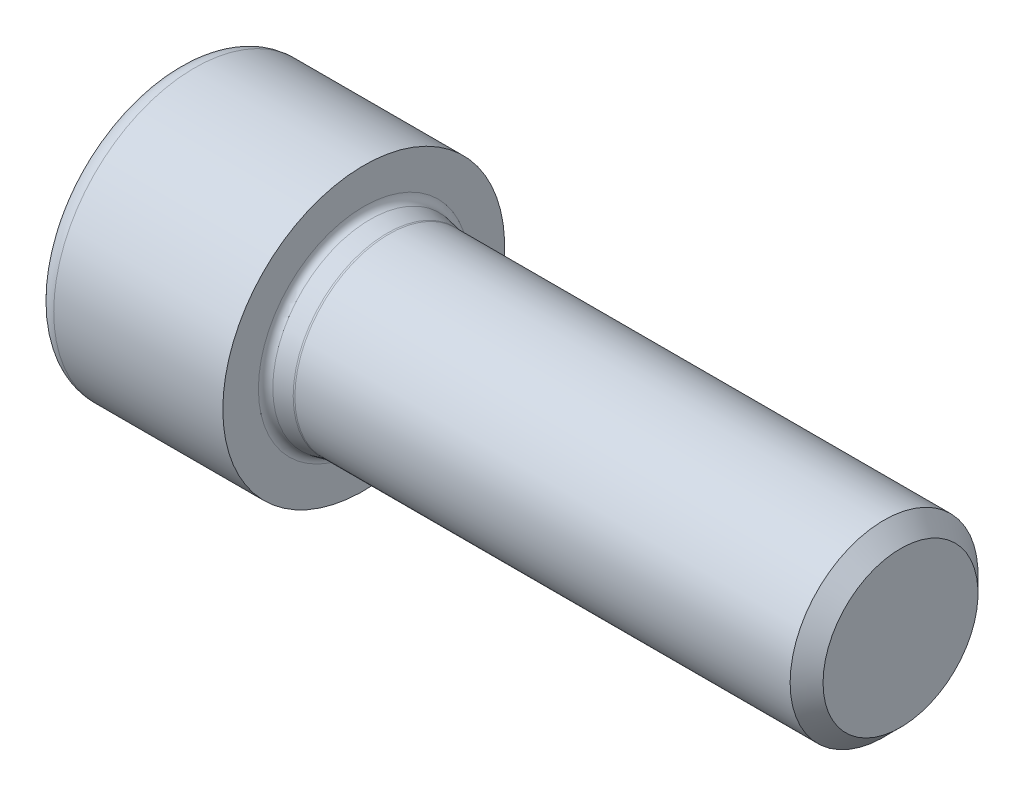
SolidWorks part; units mm, degrees
ref_plane "Ebene vorne" through (0, 0, 0) normal (0, 0, 1) x (1, 0, 0)
ref_plane "Ebene oben" through (0, 0, 0) normal (0, 1, 0) x (1, 0, 0)
ref_plane "Ebene rechts" through (0, 0, 0) normal (1, 0, 0) x (0, 0, -1)
ref_plane "Ebene1" through (0, 0, 0) normal (0, 1, 0) x (-1, 0, 0)
sketch "Skizze1" plane through (0, 0, 0) normal (0, 1, 0) x (-1, 0, 0)
  line L0 (2.3359, 0) -> (5.8, -6)
  line L1 (5.8, -6) -> (13.14, -6)
  line L2 (13.14, -6) -> (14, -6.86)
  line L3 (14, -6.86) -> (14, -9.1)
  line L4 (12.6, -10.5) -> (0, -10.5)
  line L5 (0, -10.5) -> (0, -7.85)
  line L6 (-0.4841, -7.2613) -> (-1.7541, -7.0113)
  line L7 (-1.87, -7) -> (-38.773, -7)
  line L8 (-38.773, -7) -> (-40, -5.773)
  line L9 (-40, -5.773) -> (-40, 0)
  line L10 (-40, 0) -> (2.3359, 0)
  line L11 (-40, 0) -> (14, 0) construction
  arc A0 (14, -9.1) -> (12.6, -10.5) centre (12.6, -9.1) cw
  arc A1 (0, -7.85) -> (-0.4841, -7.2613) centre (-0.6, -7.85) ccw
  arc A2 (-1.7541, -7.0113) -> (-1.87, -7) centre (-1.87, -7.6) ccw
revolve "Rotation1" add sketch "Skizze1" angle 360 about L11
ref_plane "Ebene2" through (-5.8, 0, 0) normal (1, 0, 0) x (0, 0, -1)
sketch "Skizze2" plane through (-5.8, 0, 0) normal (1, 0, 0) x (0, 0, -1)
  line L0 (-6, 3.4641) -> (-6, -3.4641)
  line L1 (-6, -3.4641) -> (0, -6.9282)
  line L2 (0, -6.9282) -> (6, -3.4641)
  line L3 (6, -3.4641) -> (6, 3.4641)
  line L4 (6, 3.4641) -> (0, 6.9282)
  line L5 (0, 6.9282) -> (-6, 3.4641)
extrude "Schnitt-Linear austragen1" cut sketch "Skizze2" against normal blind 14
